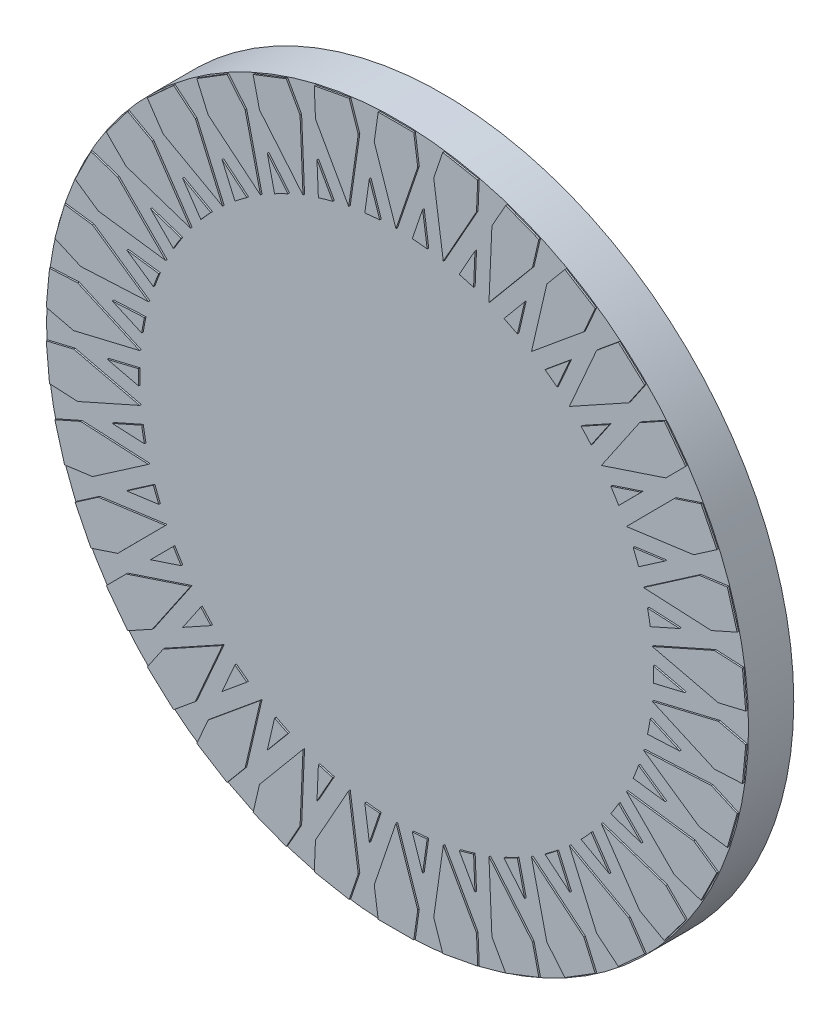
SolidWorks part; units mm, degrees
ref_plane "Plan de face" through (0, 0, 0) normal (0, 0, 1) x (1, 0, 0)
ref_plane "Plan de dessus" through (0, 0, 0) normal (0, 1, 0) x (1, 0, 0)
ref_plane "Plan de droite" through (0, 0, 0) normal (1, 0, 0) x (0, 0, -1)
sketch "Esquisse2" plane through (0, 0, 0) normal (0, 0, 1) x (1, 0, 0)
  circle A0 centre (0, 0) radius 22.5
  dimension "D1" = 45
extrude "Boss.-Extru.1" add sketch "Esquisse2" along normal blind 3
sketch "Esquisse3" plane through (0, 0, 3) normal (0, 0, 1) x (1, 0, 0)
  circle A2 centre (0, 0) radius 16.5
  circle A3 centre (0, 0) radius 16.5
  dimension "D1" = 6
extrude "Enlèv. mat.-Extru.1" cut sketch "Esquisse3" against normal blind 0.1
sketch "Esquisse4" plane through (0, 0, 3) normal (0, 0, 1) x (1, 0, 0)
  line L0 (-2, 22.4109) -> (2, 22.4109)
  line L1 (2, 22.4109) -> (0, 16.5)
  line L2 (0, 16.5) -> (-2, 22.4109)
  line L3 (0, 22.4109) -> (0, 16.5) construction
  line L4 (2.1521, 22.3968) -> (6.0839, 21.6618)
  line L5 (6.0839, 21.6618) -> (3.0319, 16.2191)
  line L6 (3.0319, 16.2191) -> (2.1521, 22.3968)
  line L7 (6.2308, 21.6201) -> (9.9607, 20.1751)
  line L8 (9.9607, 20.1751) -> (5.9605, 15.3858)
  line L9 (5.9605, 15.3858) -> (6.2308, 21.6201)
  line L10 (10.0974, 20.107) -> (13.4983, 18.0013)
  line L11 (13.4983, 18.0013) -> (8.6861, 14.0286)
  line L12 (8.6861, 14.0286) -> (10.0974, 20.107)
  line L13 (13.6201, 17.9093) -> (16.5762, 15.2145)
  line L14 (16.5762, 15.2145) -> (11.116, 12.1936)
  line L15 (11.116, 12.1936) -> (13.6201, 17.9093)
  line L16 (16.679, 15.1016) -> (19.0896, 11.9096)
  line L17 (19.0896, 11.9096) -> (13.1673, 9.9435)
  line L18 (13.1673, 9.9435) -> (16.679, 15.1016)
  line L19 (19.17, 11.7797) -> (20.9529, 8.1991)
  line L20 (20.9529, 8.1991) -> (14.7702, 7.3547)
  line L21 (14.7702, 7.3547) -> (19.17, 11.7797)
  line L22 (21.0081, 8.0567) -> (22.1027, 4.2094)
  line L23 (22.1027, 4.2094) -> (15.8701, 4.5154)
  line L24 (15.8701, 4.5154) -> (21.0081, 8.0567)
  line L25 (22.1308, 4.0593) -> (22.4999, 0.0764)
  line L26 (22.4999, 0.0764) -> (16.4296, 1.5224)
  line L27 (16.4296, 1.5224) -> (22.1308, 4.0593)
  line L28 (22.4999, -0.0764) -> (22.1308, -4.0593)
  line L29 (22.1308, -4.0593) -> (16.4296, -1.5224)
  line L30 (16.4296, -1.5224) -> (22.4999, -0.0764)
  line L31 (22.1027, -4.2094) -> (21.0081, -8.0567)
  line L32 (21.0081, -8.0567) -> (15.8701, -4.5154)
  line L33 (15.8701, -4.5154) -> (22.1027, -4.2094)
  line L34 (20.9529, -8.1991) -> (19.17, -11.7797)
  line L35 (19.17, -11.7797) -> (14.7702, -7.3547)
  line L36 (14.7702, -7.3547) -> (20.9529, -8.1991)
  line L37 (19.0896, -11.9096) -> (16.679, -15.1016)
  line L38 (16.679, -15.1016) -> (13.1673, -9.9435)
  line L39 (13.1673, -9.9435) -> (19.0896, -11.9096)
  line L40 (16.5762, -15.2145) -> (13.6201, -17.9093)
  line L41 (13.6201, -17.9093) -> (11.116, -12.1936)
  line L42 (11.116, -12.1936) -> (16.5762, -15.2145)
  line L43 (13.4983, -18.0013) -> (10.0974, -20.107)
  line L44 (10.0974, -20.107) -> (8.6861, -14.0286)
  line L45 (8.6861, -14.0286) -> (13.4983, -18.0013)
  line L46 (9.9607, -20.1751) -> (6.2308, -21.6201)
  line L47 (6.2308, -21.6201) -> (5.9605, -15.3858)
  line L48 (5.9605, -15.3858) -> (9.9607, -20.1751)
  line L49 (6.0839, -21.6618) -> (2.1521, -22.3968)
  line L50 (2.1521, -22.3968) -> (3.0319, -16.2191)
  line L51 (3.0319, -16.2191) -> (6.0839, -21.6618)
  line L52 (2, -22.4109) -> (-2, -22.4109)
  line L53 (-2, -22.4109) -> (0, -16.5)
  line L54 (0, -16.5) -> (2, -22.4109)
  line L55 (-2.1521, -22.3968) -> (-6.0839, -21.6618)
  line L56 (-6.0839, -21.6618) -> (-3.0319, -16.2191)
  line L57 (-3.0319, -16.2191) -> (-2.1521, -22.3968)
  line L58 (-6.2308, -21.6201) -> (-9.9607, -20.1751)
  line L59 (-9.9607, -20.1751) -> (-5.9605, -15.3858)
  line L60 (-5.9605, -15.3858) -> (-6.2308, -21.6201)
  line L61 (-10.0974, -20.107) -> (-13.4983, -18.0013)
  line L62 (-13.4983, -18.0013) -> (-8.6861, -14.0286)
  line L63 (-8.6861, -14.0286) -> (-10.0974, -20.107)
  line L64 (-13.6201, -17.9093) -> (-16.5762, -15.2145)
  line L65 (-16.5762, -15.2145) -> (-11.116, -12.1936)
  line L66 (-11.116, -12.1936) -> (-13.6201, -17.9093)
  line L67 (-16.679, -15.1016) -> (-19.0896, -11.9096)
  line L68 (-19.0896, -11.9096) -> (-13.1673, -9.9435)
  line L69 (-13.1673, -9.9435) -> (-16.679, -15.1016)
  line L70 (-19.17, -11.7797) -> (-20.9529, -8.1991)
  line L71 (-20.9529, -8.1991) -> (-14.7702, -7.3547)
  line L72 (-14.7702, -7.3547) -> (-19.17, -11.7797)
  line L73 (-21.0081, -8.0567) -> (-22.1027, -4.2094)
  line L74 (-22.1027, -4.2094) -> (-15.8701, -4.5154)
  line L75 (-15.8701, -4.5154) -> (-21.0081, -8.0567)
  line L76 (-22.1308, -4.0593) -> (-22.4999, -0.0764)
  line L77 (-22.4999, -0.0764) -> (-16.4296, -1.5224)
  line L78 (-16.4296, -1.5224) -> (-22.1308, -4.0593)
  line L79 (-22.4999, 0.0764) -> (-22.1308, 4.0593)
  line L80 (-22.1308, 4.0593) -> (-16.4296, 1.5224)
  line L81 (-16.4296, 1.5224) -> (-22.4999, 0.0764)
  line L82 (-22.1027, 4.2094) -> (-21.0081, 8.0567)
  line L83 (-21.0081, 8.0567) -> (-15.8701, 4.5154)
  line L84 (-15.8701, 4.5154) -> (-22.1027, 4.2094)
  line L85 (-20.9529, 8.1991) -> (-19.17, 11.7797)
  line L86 (-19.17, 11.7797) -> (-14.7702, 7.3547)
  line L87 (-14.7702, 7.3547) -> (-20.9529, 8.1991)
  line L88 (-19.0896, 11.9096) -> (-16.679, 15.1016)
  line L89 (-16.679, 15.1016) -> (-13.1673, 9.9435)
  line L90 (-13.1673, 9.9435) -> (-19.0896, 11.9096)
  line L91 (-16.5762, 15.2145) -> (-13.6201, 17.9093)
  line L92 (-13.6201, 17.9093) -> (-11.116, 12.1936)
  line L93 (-11.116, 12.1936) -> (-16.5762, 15.2145)
  line L94 (-13.4983, 18.0013) -> (-10.0974, 20.107)
  line L95 (-10.0974, 20.107) -> (-8.6861, 14.0286)
  line L96 (-8.6861, 14.0286) -> (-13.4983, 18.0013)
  line L97 (-9.9607, 20.1751) -> (-6.2308, 21.6201)
  line L98 (-6.2308, 21.6201) -> (-5.9605, 15.3858)
  line L99 (-5.9605, 15.3858) -> (-9.9607, 20.1751)
  line L100 (-6.0839, 21.6618) -> (-2.1521, 22.3968)
  line L101 (-2.1521, 22.3968) -> (-3.0319, 16.2191)
  line L102 (-3.0319, 16.2191) -> (-6.0839, 21.6618)
  circle A0 centre (0, 0) radius 16.5 construction
  circle A1 centre (0, 0) radius 16.5
  circle A2 centre (0, 0) radius 16.5 construction
  circle A3 centre (0, 0) radius 22.5 construction
  point P14 (0, 0)
  point P16 (0, 0)
  point P112 (0, 0)
  point P113 (0, 0)
  point P114 (0, 0)
  point P115 (0, 0)
  point P116 (0, 0)
  point P117 (3.0319, 16.2191)
  dimension "D2" = 34
  dimension "D3" = 0.1527
  dimension "D1" = 0
extrude "Enlèv. de mat.-Extru.-Mince1" cut sketch "Esquisse4" against normal blind 0.1 thin
